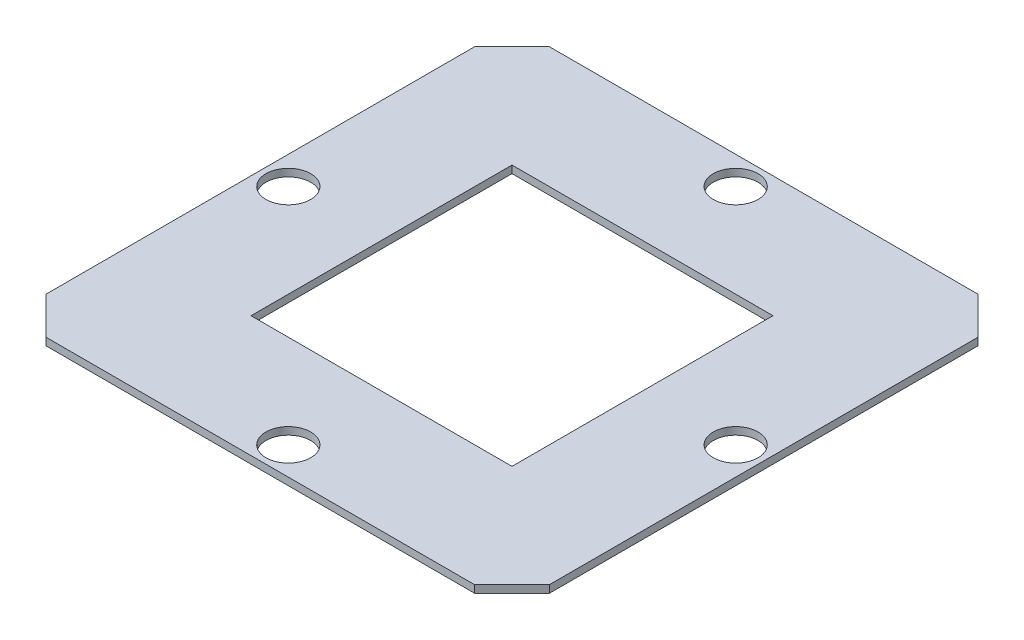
SolidWorks part; units mm, degrees
ref_plane "Спереди" through (0, 0, 0) normal (0, 0, 1) x (1, 0, 0)
ref_plane "Сверху" through (0, 0, 0) normal (0, 1, 0) x (1, 0, 0)
ref_plane "Справа" through (0, 0, 0) normal (1, 0, 0) x (0, 0, -1)
sketch "Sketch1" plane through (0, 0, 0) normal (0, 1, 0) x (1, 0, 0)
  line L0 (0, 72.0616) -> (0, -71.2071) construction
  line L1 (78.6127, 0) -> (-74.3402, 0) construction
  line L2 (-67.5, -67.5) -> (-67.5, 67.5)
  line L3 (-67.5, 67.5) -> (67.5, 67.5)
  line L4 (67.5, -67.5) -> (67.5, 67.5)
  line L5 (-67.5, -67.5) -> (67.5, -67.5)
  dimension "D1" = 135
extrude "Extrude1" add sketch "Sketch1" along normal blind 2
sketch "Sketch2" plane through (0, 2, 0) normal (0, 1, 0) x (1, 0, 0)
  line L0 (0, 76.5594) -> (0, -79.029) construction
  line L1 (96.8654, 0) -> (-89.1821, 0) construction
  circle A0 centre (0, 60) radius 6
  circle A1 centre (60, 0) radius 6
  circle A2 centre (0, -60) radius 6
  circle A3 centre (-60, 0) radius 6
  dimension "D1" = 120
  dimension "D2" = 12
extrude "Cut-Extrude1" cut sketch "Sketch2" against normal through all
chamfer "Chamfer1" distance 10 angle 45 4 edges at (-67.5, 1, -67.5) (67.5, 1, -67.5) (67.5, 1, 67.5) (-67.5, 1, 67.5)
sketch "Sketch3" plane through (0, 0, 0) normal (0, -1, 0) x (1, 0, 0)
  line L0 (0, 82.0686) -> (0, -95.6099) construction
  line L1 (89.8651, 0) -> (-103.4064, 0) construction
  line L2 (-35, -35) -> (-35, 35)
  line L3 (-35, 35) -> (35, 35)
  line L4 (-35, -35) -> (35, -35)
  line L5 (35, -35) -> (35, 35)
  dimension "D1" = 70
extrude "Cut-Extrude2" cut sketch "Sketch3" against normal up to next
